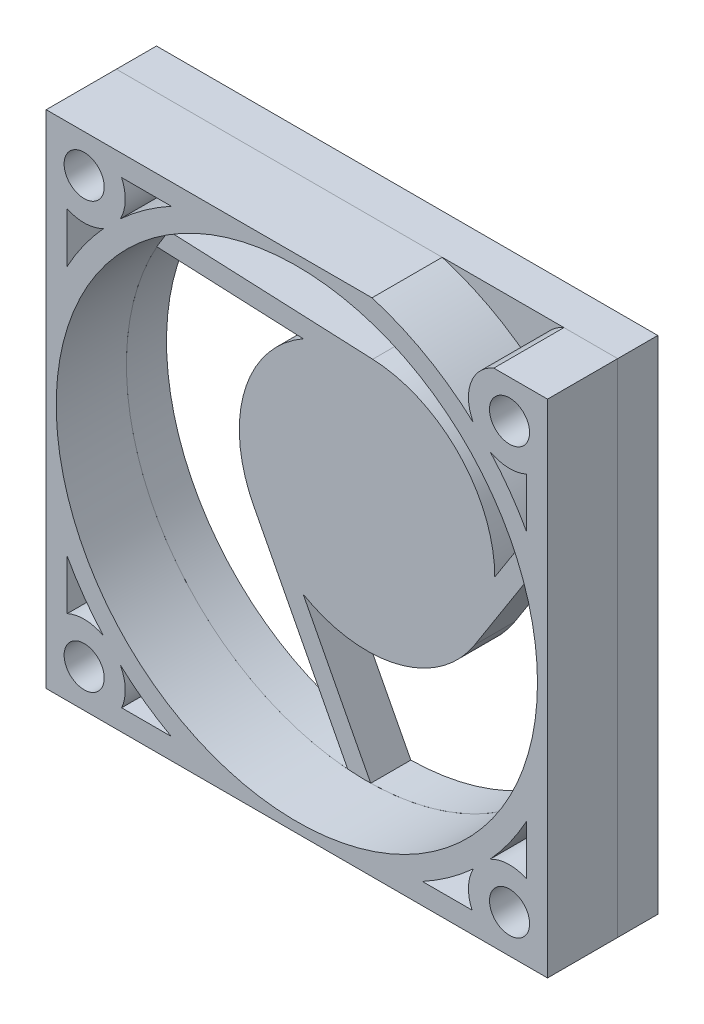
SolidWorks part; units mm, degrees
ref_plane "Face" through (0, 0, 0) normal (0, 0, 1) x (1, 0, 0)
ref_plane "Dessus" through (0, 0, 0) normal (0, 1, 0) x (1, 0, 0)
ref_plane "Droite" through (0, 0, 0) normal (1, 0, 0) x (0, 0, -1)
sketch "Esquisse1" plane through (0, 0, 0) normal (0, 0, 1) x (1, 0, 0)
  line L0 (0, 0) -> (-25, 25) construction
  line L1 (-25, 25) -> (25, 25)
  line L2 (-25, 25) -> (-25, -25)
  line L3 (-25, -25) -> (25, -25)
  line L4 (25, 25) -> (25, -25)
  circle A0 centre (-21.2132, 21.2132) radius 2
  circle A1 centre (0, 0) radius 24
  circle A2 centre (21.2132, 21.2132) radius 2
  circle A3 centre (21.2132, -21.2132) radius 2
  circle A4 centre (-21.2132, -21.2132) radius 2
  dimension "D1" = 25
  dimension "D5" = 30
  dimension "D2" = 25
  dimension "D3" = 50
  dimension "D4" = 50
extrude "Extrusion1" add sketch "Esquisse1" along normal blind 7
sketch "Esquisse2" plane through (0, 0, 0) normal (0, 0, 1) x (1, 0, 0)
  line L0 (10.7392, -6.8525) -> (21.6802, 10.2941)
  line L1 (-25, 25) -> (25, 25)
  line L2 (-25, 25) -> (-25, -25)
  line L3 (-25, -25) -> (25, -25)
  line L4 (25, 25) -> (25, -25)
  line L5 (20.5984, 12.3169) -> (12.7392, 0)
  line L6 (0.3675, -23.9972) -> (-6.3696, -11.0325)
  line L7 (-11.3041, -5.8742) -> (-1.9251, -23.9227)
  line L8 (-20.9659, 11.6803) -> (-6.3696, 11.0325)
  line L9 (0.5648, 12.7267) -> (-19.7551, 13.6285)
  arc A0 (12.7392, 0) -> (0.5648, 12.7267) centre (0, 0) ccw
  arc A1 (-6.3696, 11.0325) -> (-11.3041, -5.8742) centre (0, 0) ccw
  arc A2 (20.5984, 12.3169) -> (-19.7551, 13.6285) centre (0, 0) ccw
  arc A3 (-6.3696, -11.0325) -> (10.7392, -6.8525) centre (0, 0) ccw
  arc A4 (-20.9659, 11.6803) -> (-1.9251, -23.9227) centre (0, 0) ccw
  arc A5 (0.3675, -23.9972) -> (21.6802, 10.2941) centre (0, 0) ccw
  circle A6 centre (-21.2132, 21.2132) radius 2
  circle A7 centre (21.2132, 21.2132) radius 2
  circle A8 centre (21.2132, -21.2132) radius 2
  circle A9 centre (-21.2132, -21.2132) radius 2
  dimension "D1" = 2
extrude "Extrusion3" add sketch "Esquisse2" against normal blind 4 separate body
shell "Coque2" thickness 2.1
sketch "Esquisse4" plane through (0, 0, 0) normal (0, 0, 1) x (1, 0, 0)
  line L0 (4.1034, 25.7754) -> (20.6986, 25.2808)
  arc A0 (17.6026, 19.2707) -> (20.6986, 25.2808) centre (21.2132, 21.2132) cw
  arc A1 (17.6026, 19.2707) -> (4.1034, 25.7754) centre (0, 0) ccw
extrude "Enlèv. mat.-Extru.3" cut sketch "Esquisse4" along normal through all
